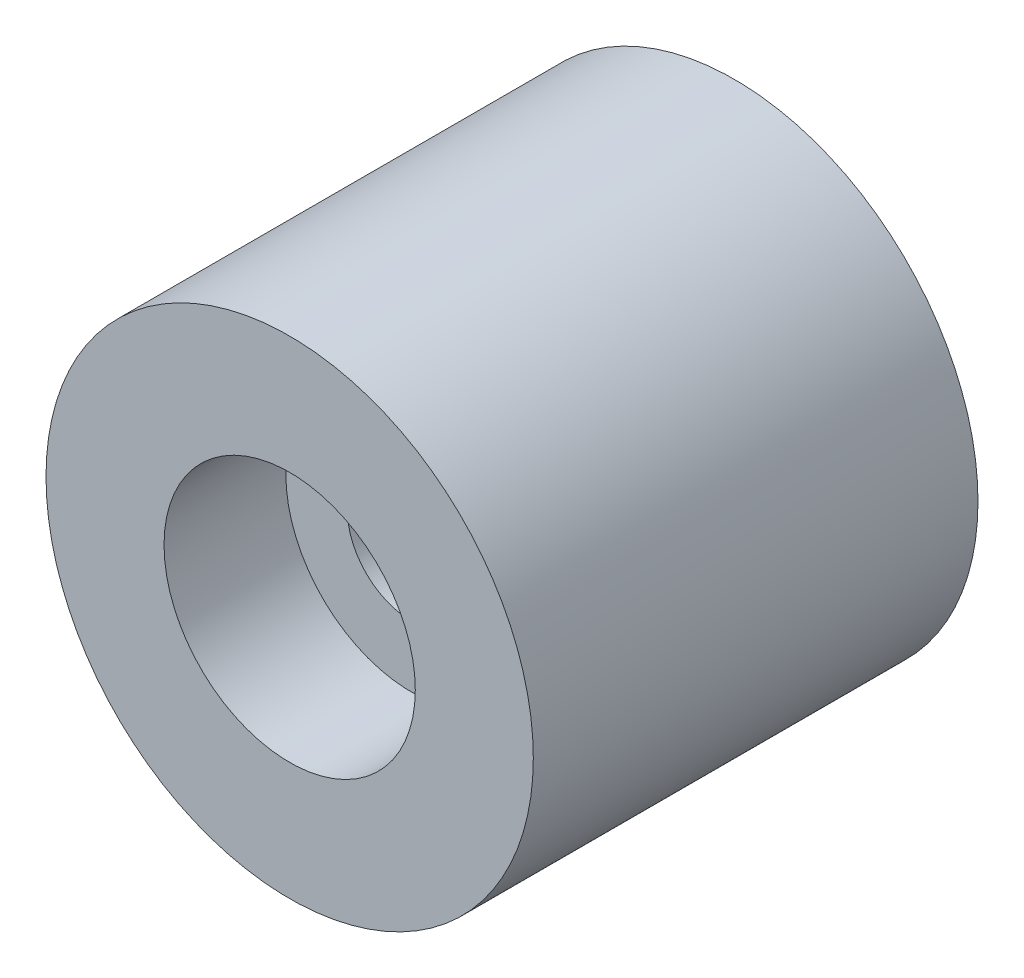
SolidWorks part; units mm, degrees
ref_plane "Front Plane" through (0, 0, 0) normal (0, 0, 1) x (1, 0, 0)
ref_plane "Top Plane" through (0, 0, 0) normal (0, 1, 0) x (1, 0, 0)
ref_plane "Right Plane" through (0, 0, 0) normal (1, 0, 0) x (0, 0, -1)
sketch "Sketch1" plane through (0, 0, 0) normal (0, 1, 0) x (1, 0, 0)
  line L0 (2.1082, -10.6) -> (4.125, -10.6)
  line L1 (4.125, -10.6) -> (4.125, -14.6)
  line L2 (4.125, -14.6) -> (8, -14.6)
  line L3 (8, -14.6) -> (8, 0)
  line L4 (8, 0) -> (2.1082, 0)
  line L5 (2.1082, 0) -> (2.1082, -10.6)
  line L6 (0, 0) -> (0, -14.6) construction
revolve "Revolve1" add sketch "Sketch1" angle 360 about L6
